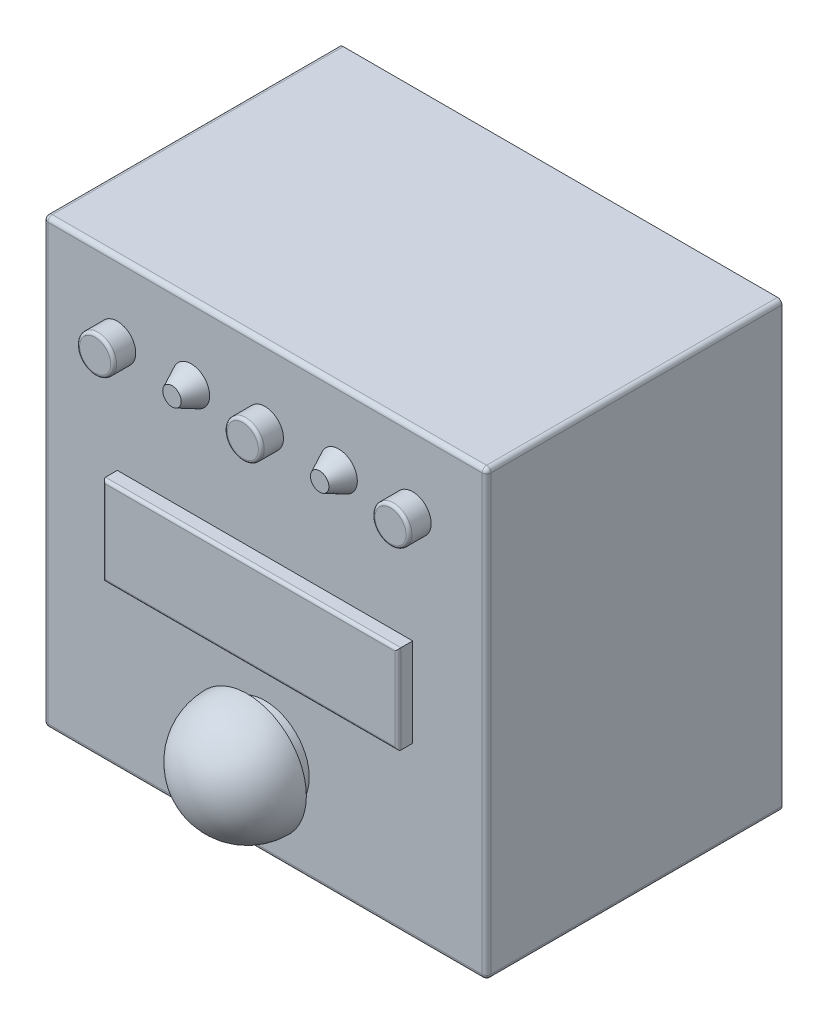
SolidWorks part; units mm, degrees
ref_plane "Face" through (0, 0, 0) normal (0, 0, 1) x (1, 0, 0)
ref_plane "Dessus" through (0, 0, 0) normal (0, 1, 0) x (1, 0, 0)
ref_plane "Droite" through (0, 0, 0) normal (1, 0, 0) x (0, 0, -1)
sketch "Esquisse1" plane through (0, 0, 0) normal (0, 0, 1) x (1, 0, 0)
  line L1 (0, 0) -> (300, 0)
  line L2 (0, 0) -> (0, 300)
  line L3 (0, 300) -> (300, 300)
  line L4 (300, 0) -> (300, 300)
  dimension "D1" = 300
  dimension "D2" = 300
extrude "Extrusion1" add sketch "Esquisse1" along normal blind 200
shell "Coque1" thickness 5
ref_plane "Plan1" through (100, 0, 0) normal (1, 0, 0) x (0, 0, -1)
sketch "Esquisse2" plane through (0, 0, 200) normal (0, 0, 1) x (1, 0, 0)
  line L0 (0, 300) -> (0, 0) construction
  line L2 (300, 300) -> (0, 300) construction
  circle A0 centre (50, 250) radius 12.5
  circle A3 centre (150, 250) radius 12.5
  circle A6 centre (250, 250) radius 12.5
  dimension "D1" = 50
  dimension "D6" = 25
  dimension "D8" = 25
  dimension "D10" = 25
  dimension "D11" = 50
extrude "Extrusion2" add sketch "Esquisse2" along normal blind 15
fillet "Congé1" radius 2 3 edges at (262.5, 250, 215) (162.5, 250, 215) (62.5, 250, 215)
sketch "Esquisse3" plane through (0, 0, 200) normal (0, 0, 1) x (1, 0, 0)
  line L0 (300, 300) -> (0, 300) construction
  line L1 (50, 175) -> (250, 175)
  line L2 (50, 175) -> (50, 115)
  line L3 (50, 115) -> (250, 115)
  line L4 (250, 175) -> (250, 115)
  dimension "D1" = 60
  dimension "D2" = 125
extrude "Extrusion3" add sketch "Esquisse3" along normal blind 10
fillet "Congé2" radius 2 4 edges at (250, 145, 210) (150, 115, 210) (150, 175, 210) (50, 145, 210)
sketch "Esquisse4" plane through (0, 0, 200) normal (0, 0, 1) x (1, 0, 0)
  line L2 (0, 300) -> (0, 0) construction
  line L3 (0, 0) -> (300, 0) construction
  circle A0 centre (150, 60) radius 30
  dimension "D1" = 150
  dimension "D2" = 60
  dimension "D3" = 60
extrude "Extrusion4" add sketch "Esquisse4" along normal blind 12
sketch "Esquisse5" plane through (0, 0, 212) normal (0, 0, 1) x (1, 0, 0)
  line L0 (190, 60) -> (110, 60)
  arc A0 (190, 60) -> (110, 60) centre (150, 60) ccw
  dimension "D1" = 80
revolve "Révolution2" add sketch "Esquisse5" angle 180 about L0
fillet "Congé4" radius 3 8 edges at (0, 0, 100) (300, 0, 100) (150, 0, 200) (300, 150, 200) (300, 300, 100) (0, 300, 100) (150, 300, 200) (0, 150, 200)
sketch "Esquisse6" plane through (100, 0, 0) normal (1, 0, 0) x (0, 0, -1)
  line L0 (-200, 250) -> (-200, 262.5)
  line L1 (-200, 3) -> (-200, 297) construction
  line L2 (-200, 262.5) -> (-213, 256.25)
  line L3 (-213, 237.5) -> (-213, 262.5) construction
  line L4 (-213, 256.25) -> (-213, 250)
  line L5 (-213, 250) -> (-200, 250)
  dimension "D1" = 13
  dimension "D2" = 6.25
  dimension "D3" = 25.677
revolve "Révolution3" add sketch "Esquisse6" angle 360 about L5
pattern_linear "Répétition linéaire2" count 2 spacing 100 along (1, 0, 0) of "Révolution3"
